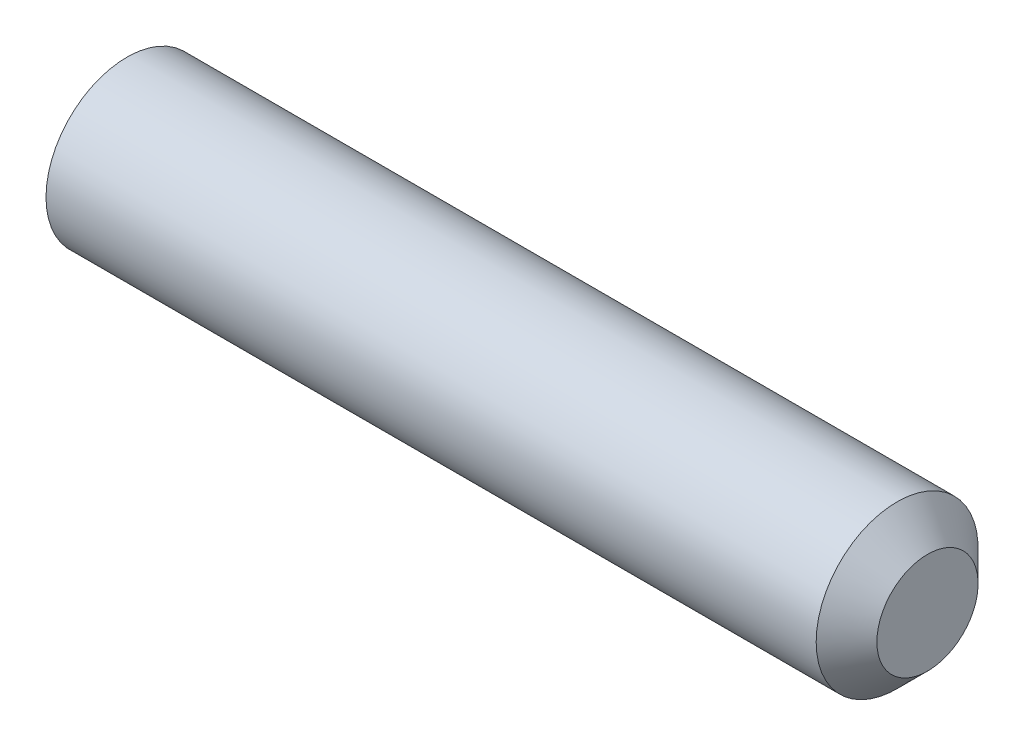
SolidWorks part; units mm, degrees
revolve "BaseBody" add sketch "BodySke" angle 360 about L5
sketch "BodySke" plane through (0, 0, 0) normal (0, 0, 1) x (1, 0, 0)
  line L0 (0, 0) -> (0, 1.61)
  line L1 (0, 1.61) -> (0.2252, 2)
  line L2 (0.2252, 2) -> (19.25, 2)
  line L3 (19.25, 2) -> (20, 1.25)
  line L4 (20, 0) -> (0, 0)
  line L5 (-12.7, 0) -> (88.9, 0) construction
  line L6 (20, 1.25) -> (20, 0)
  line L7 (20, 1.25) -> (20, 10.775) construction
  line L8 (0, -1.61) -> (0.2252, -2) construction
  line L9 (0.7, 15.875) -> (0.7, -3.175) construction
  line L10 (19.25, -2) -> (20, -1.25) construction
ref_plane "Plane1" through (0, 0, 0) normal (0, 0, 1) x (1, 0, 0)
ref_plane "Plane2" through (0, 0, 0) normal (0, 1, 0) x (1, 0, 0)
ref_plane "Plane3" through (0, 0, 0) normal (1, 0, 0) x (0, 0, -1)
other "Configuration Table"
sketch "Sketch2" plane through (0, 0, 0) normal (-1, 0, 0) x (0, 0, 1)
  line L0 (0.5774, 1) -> (-0.5774, 1)
  line L1 (-0.5774, 1) -> (-1.1547, 0)
  line L2 (0.5774, 1) -> (1.1547, 0)
  line L3 (0.5774, -1) -> (1.1547, 0)
  line L4 (0.5774, -1) -> (-0.5774, -1)
  line L5 (-0.5774, -1) -> (-1.1547, 0)
extrude "Hex" cut sketch "Sketch2" against normal blind 2.5
sketch "ThdSchSke" plane through (0, 0, 0) normal (0, 0, 1) x (1, 0, 0)
  line L0 (0.2252, -1.61) -> (-0.0479, -2)
  line L1 (0.2252, -1.61) -> (0.4982, -2)
  line L2 (0.4982, -2) -> (0.4982, -2.5)
  line L3 (-3.175, 0) -> (5.1513, 0) construction
  line L5 (0.4982, -2.5) -> (-0.0479, -2.5)
  line L6 (-0.0479, -2.5) -> (-0.0479, -2)
  line L8 (0.2252, 2) -> (0.2252, -2) construction
revolve "ThreadSchematic" [suppressed] cut sketch "ThdSchSke" angle 360 about L3
pattern_linear "ThdSchPat" [suppressed]
equation "\"D2@Sketch2\" = \"Hex_size@Sketch2\" / 2"
equation "\"D3@Sketch2\" = \"Hex_size@Sketch2\" / 2"
equation "\"Thread_minor@ThreadCosmetic\" = \"Minor_dia@BodySke\""
equation "\"Thread_minor@ThdSchSke\" = \"Thread_minor@ThreadCosmetic\""
equation "\"Diameter@ThdSchSke\" = \"Diameter@BodySke\""
equation "\"Overcut@ThdSchSke\" = \"Diameter@BodySke\" * 1.25"
equation "\"Num_threads@ThdSchPat\" = int( (\"Length@BodySke\" - ( ( ( \"Diameter@BodySke\" - \"Minor_dia@BodySke\" ) * 0.5 ) / tan( \"Drive_ch_ang@BodySke\" * 0.017453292 ) ) - ( ( ( \"Diameter@BodySke\" - \"Cup_dia@BodySk"
equation "\"Advance@ThdSchPat\" = (\"Length@BodySke\" - ( ( ( \"Diameter@BodySke\" - \"Minor_dia@BodySke\" ) * 0.5 ) / tan( \"Drive_ch_ang@BodySke\" * 0.017453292 ) ) - ( ( ( \"Diameter@BodySke\" - \"Cup_dia@BodySke\" ) * 0."
equation "' \"Num_threads@ThdSchPat\" = \"Num_threads@ThdSchPat\" - sgn( \"Num_threads@ThdSchPat\" - 1) '---chamfered tips only---"
